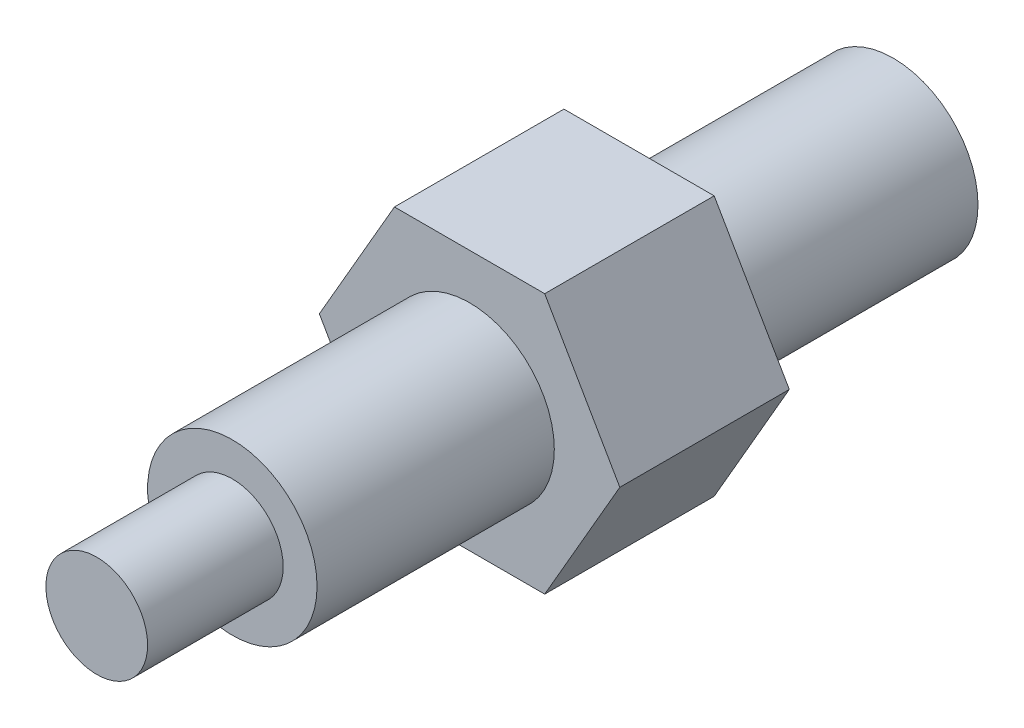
SolidWorks part; units mm, degrees
ref_plane "Face" through (0, 0, 0) normal (0, 0, 1) x (1, 0, 0)
ref_plane "Dessus" through (0, 0, 0) normal (0, 1, 0) x (1, 0, 0)
ref_plane "Droite" through (0, 0, 0) normal (1, 0, 0) x (0, 0, -1)
sketch "Esquisse1" plane through (0, 0, 0) normal (0, 0, 1) x (1, 0, 0)
  line L0 (5.25, 0) -> (-5.25, 0) construction
  line L1 (4.4326, -7.6775) -> (8.8652, 0)
  line L2 (8.8652, 0) -> (4.4326, 7.6775)
  line L3 (4.4326, 7.6775) -> (-4.4326, 7.6775)
  line L4 (-4.4326, 7.6775) -> (-8.8652, 0)
  line L5 (-8.8652, 0) -> (-4.4326, -7.6775)
  line L6 (-4.4326, -7.6775) -> (4.4326, -7.6775)
  circle A0 centre (0, 0) radius 8.8652 construction
extrude "Base-Extrusion" add sketch "Esquisse1" along normal blind 10
sketch "Esquisse2" plane through (0, 0, 10) normal (0, 0, 1) x (1, 0, 0)
  circle A0 centre (0, 0) radius 5
  dimension "D1" = 10
extrude "Boss.-Extru.1" add sketch "Esquisse2" along normal blind 14
sketch "Esquisse3" plane through (0, 0, 24) normal (0, 0, 1) x (1, 0, 0)
  circle A0 centre (0, 0) radius 3
  dimension "D1" = 6
extrude "Boss.-Extru.2" add sketch "Esquisse3" along normal blind 8
sketch "Esquisse5" plane through (0, 0, 0) normal (0, 0, -1) x (-1, 0, 0)
  circle A0 centre (0, 0) radius 5
  dimension "D1" = 10
extrude "Boss.-Extru.3" add sketch "Esquisse5" along normal blind 15
ref_plane "Plan1" through (0, 0, 17) normal (0, 0, 1) x (1, 0, 0)
sketch "Esquisse6" plane through (0, 0, 17) normal (0, 0, 1) x (1, 0, 0)
  point P0 (0, 0)
